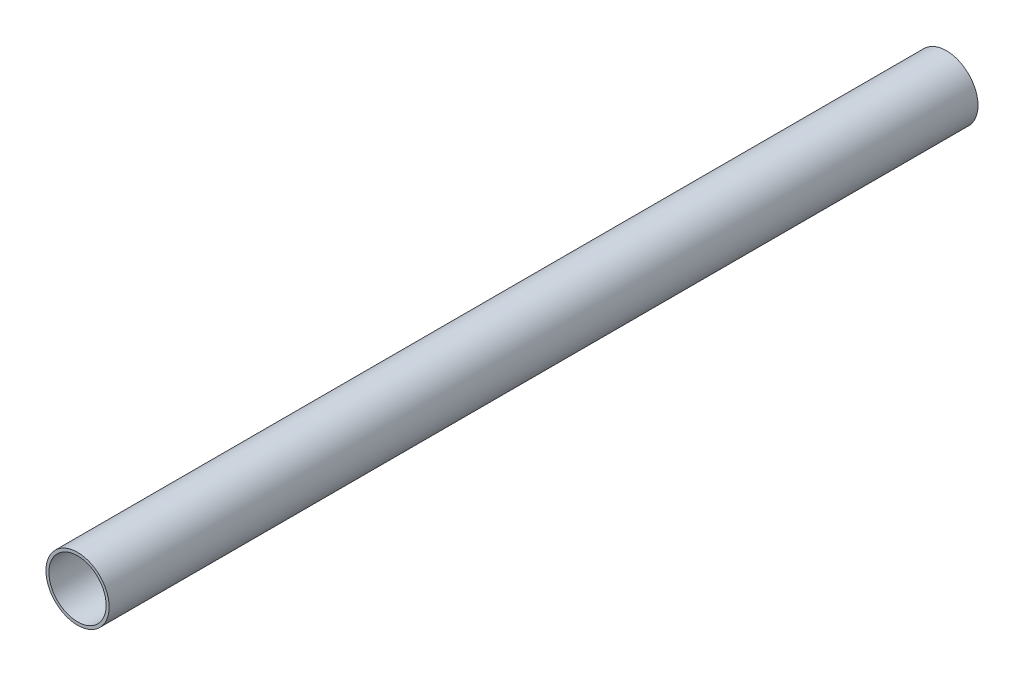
SolidWorks part; units mm, degrees
ref_plane "Front Plane" through (0, 0, 0) normal (0, 0, 1) x (1, 0, 0)
ref_plane "Top Plane" through (0, 0, 0) normal (0, 1, 0) x (1, 0, 0)
ref_plane "Right Plane" through (0, 0, 0) normal (1, 0, 0) x (0, 0, -1)
sketch "Sketch1" plane through (0, 0, 0) normal (0, 0, 1) x (1, 0, 0)
  circle A0 centre (0, 0) radius 8
  dimension "D1" = 16
extrude "Extrude1" add sketch "Sketch1" against normal blind 220
sketch "Sketch2" plane through (0, 0, 0) normal (0, 0, 1) x (1, 0, 0)
  circle A0 centre (0, 0) radius 7.25
  dimension "D1" = 14.5
extrude "Cut-Extrude1" cut sketch "Sketch2" against normal through all
